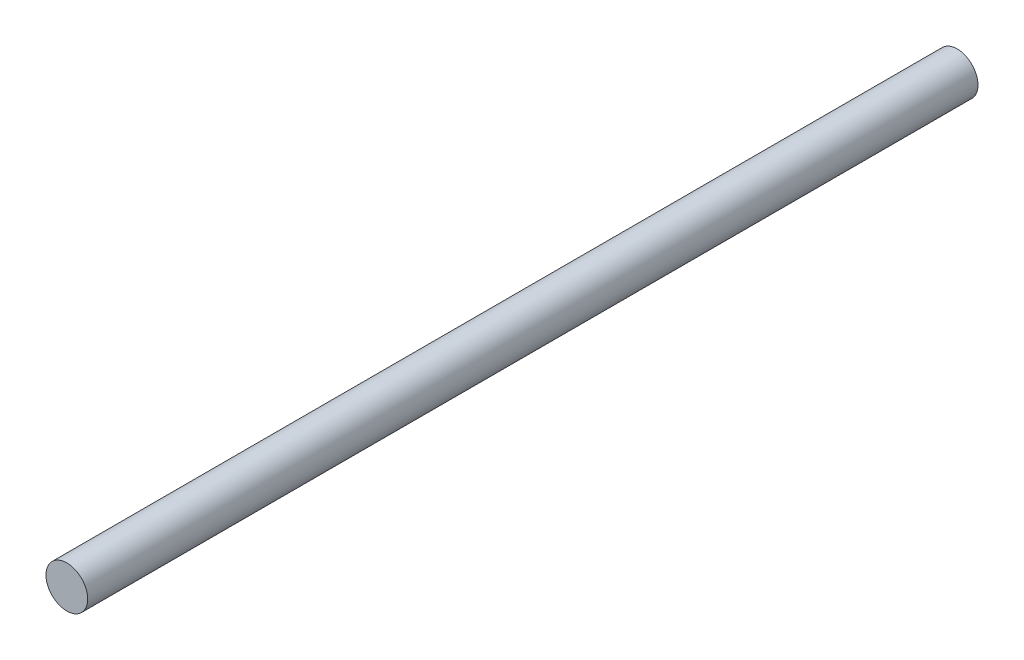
SolidWorks part; units mm, degrees
ref_plane "Front Plane" through (0, 0, 0) normal (0, 0, 1) x (1, 0, 0)
ref_plane "Top Plane" through (0, 0, 0) normal (0, 1, 0) x (1, 0, 0)
ref_plane "Right Plane" through (0, 0, 0) normal (1, 0, 0) x (0, 0, -1)
sketch "Sketch2" plane through (0, 0, 0) normal (0, 0, 1) x (1, 0, 0)
  circle A0 centre (0, 0) radius 1.1906
  dimension "D1" = 2.3813
extrude "Boss-Extrude1" add sketch "Sketch2" along normal mid plane 50.8
